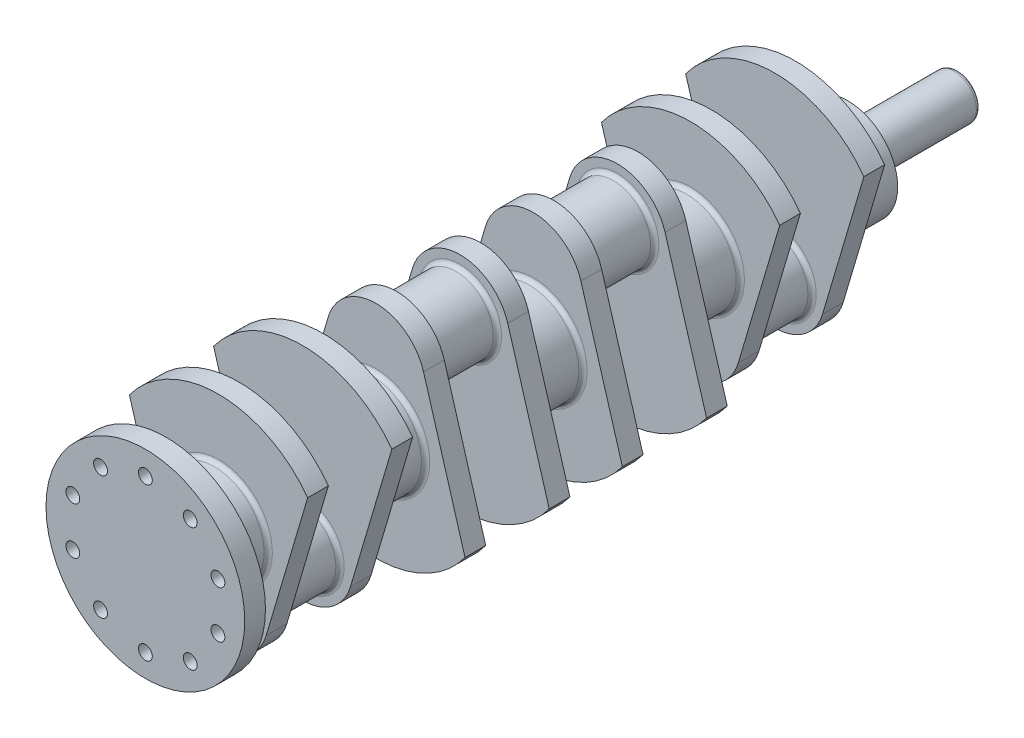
SolidWorks part; units mm, degrees
ref_plane "Front Plane" through (0, 0, 0) normal (0, 0, 1) x (1, 0, 0)
ref_plane "Top Plane" through (0, 0, 0) normal (0, 1, 0) x (1, 0, 0)
ref_plane "Right Plane" through (0, 0, 0) normal (1, 0, 0) x (0, 0, -1)
sketch "Sketch2" plane through (0, 0, 0) normal (0, 0, 1) x (1, 0, 0)
  line L0 (-64.5699, 91.2306) -> (-34.5175, -10.2246)
  line L1 (64.5699, 91.2306) -> (34.5175, -10.2246)
  circle A1 centre (0, 0) radius 36
  arc A2 (-64.5699, 91.2306) -> (64.5699, 91.2306) centre (0, 44) cw
  point P5 (0, 44)
extrude "Boss-Extrude1" add sketch "Sketch2" along normal blind 15
sketch "Sketch3" plane through (0, 0, 15) normal (0, 0, 1) x (1, 0, 0)
  circle A0 centre (0, 0) radius 27
extrude "Boss-Extrude2" add sketch "Sketch3" along normal blind 23
sketch "Sketch4" plane through (0, 0, 0) normal (0, 0, -1) x (-1, 0, 0)
  circle A0 centre (0, 44) radius 36
  point P0 (0, 44)
  dimension "D1" = 44
extrude "Boss-Extrude3" add sketch "Sketch4" along normal blind 38
fillet "Fillet1" radius 3 2 edges at (-36, 44, 0) (27, 0, 15)
mirror "Mirror1" about plane through (0, 0, 38) normal (0, 0, 1)
ref_plane "Plane2" through (0, 0, 95) normal (0, 0, 1) x (1, 0, 0)
mirror "Mirror3" about plane through (0, 0, 95) normal (0, 0, 1)
move or copy body "Body-Move/Copy2" bodies to move or copy 105 copy no rotation origin (0, 44, 152) rotation axis (1, 0, 0) rotation angle 180
ref_plane "Plane3" through (0, 0, 209) normal (0, 0, 1) x (1, 0, 0)
mirror "Mirror4" about plane through (0, 0, 209) normal (0, 0, 1)
sketch "Sketch5" plane through (0, 0, -38) normal (0, 0, -1) x (-1, 0, 0)
  circle A0 centre (0, 44) radius 16
extrude "Boss-Extrude4" add sketch "Sketch5" along normal blind 80
fillet "Fillet2" radius 3 1 edges at (-16, 44, -38)
sketch "Sketch6" plane through (0, 0, 456) normal (0, 0, 1) x (1, 0, 0)
  circle A0 centre (0, 44) radius 72
extrude "Boss-Extrude5" add sketch "Sketch6" along normal blind 15
sketch "Sketch8" plane through (0, 0, 471) normal (0, 0, 1) x (1, 0, 0)
  circle A0 centre (0, 44) radius 55
  circle A1 centre (0, 99) radius 5
  point P5 (-116.6754, 44)
extrude "Cut-Extrude1" cut sketch "Sketch8" against normal blind 15 contours A0 A1 | A0 A1
pattern_circular "CirPattern1" count 10 over 360 about axis through (0, 43.7335, 0) along (0, 0, 1) of "Cut-Extrude1"
combine bodies "Combine1" operation type add bodies to combine 110 107 108 113
fillet "Fillet3" radius 3 2 edges at (-36, 44, 456) (-16, 44, -118)
